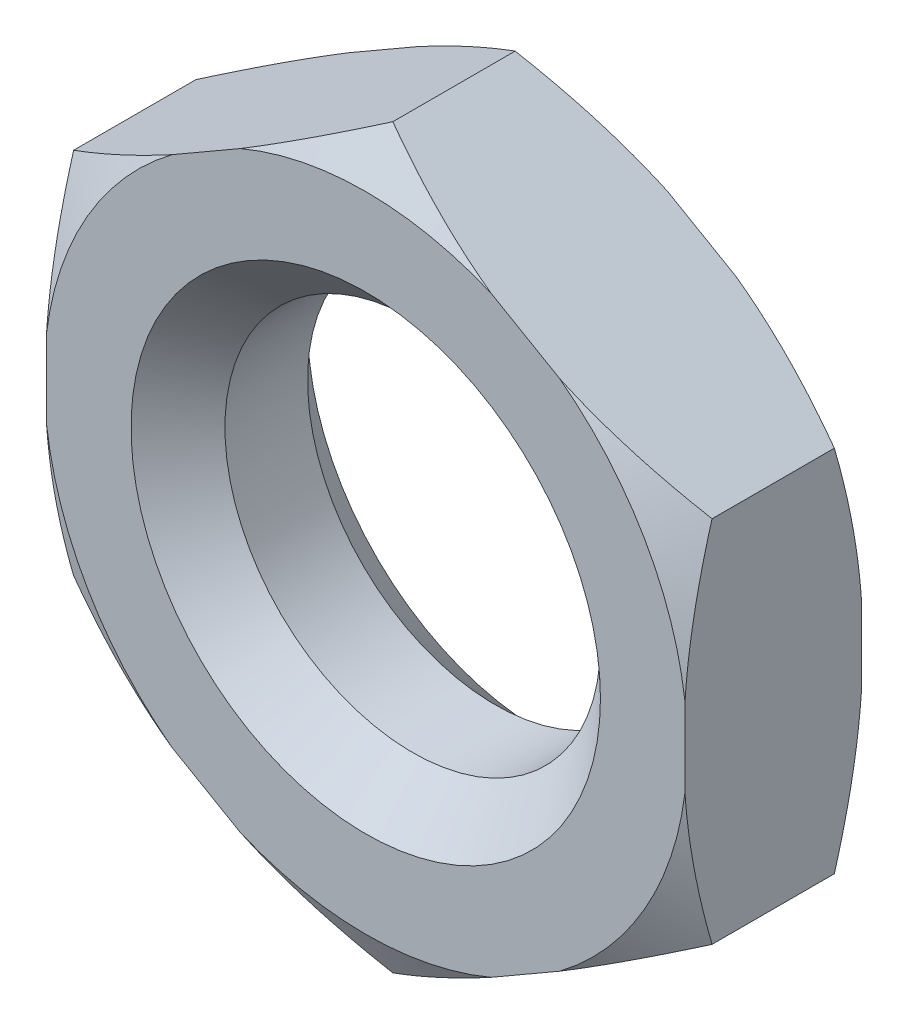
SolidWorks part; units mm, degrees
ref_plane "Front Plane" through (0, 0, 0) normal (0, 0, 1) x (1, 0, 0)
ref_plane "Top Plane" through (0, 0, 0) normal (0, 1, 0) x (1, 0, 0)
ref_plane "Right Plane" through (0, 0, 0) normal (1, 0, 0) x (0, 0, -1)
sketch "Sketch3" plane through (0, 0, 0) normal (0, 0, 1) x (1, 0, 0)
  line L1 (0, 9.815) -> (-8.5, 4.9075)
  line L2 (-8.5, 4.9075) -> (-8.5, -4.9075)
  line L3 (-8.5, -4.9075) -> (0, -9.815)
  line L4 (0, -9.815) -> (8.5, -4.9075)
  line L5 (8.5, -4.9075) -> (8.5, 4.9075)
  line L6 (8.5, 4.9075) -> (0, 9.815)
  circle A0 centre (0, 0) radius 8.5 construction
  dimension "D1" = 17
extrude "Boss-Extrude1" add sketch "Sketch3" along normal mid plane 4.7
sketch "Sketch4" plane through (0, 0, 0) normal (1, 0, 0) x (0, 0, -1)
  line L0 (-5.4578, 0) -> (6.1545, 0) construction
sketch "Sketch5" plane through (0, 0, 0) normal (1, 0, 0) x (0, 0, -1)
  line L0 (-2.35, 9.815) -> (-2.35, 8.565)
  line L1 (-2.35, 4.9075) -> (-2.35, 9.815) construction
  line L2 (-2.35, 8.565) -> (-1.6283, 9.815)
  line L3 (-2.35, 9.815) -> (2.35, 9.815) construction
  line L4 (-1.6283, 9.815) -> (-2.35, 9.815)
  dimension "D1" = 1.25
  dimension "D2" = 30
revolve "Cut-Revolve1" cut sketch "Sketch5" angle 360 about L0
mirror "Mirror1" about plane through (0, 0, 0) normal (0, 0, 1) of "Cut-Revolve1"
sketch "Sketch6" plane through (0, 0, 2.35) normal (0, 0, 1) x (1, 0, 0)
  circle A0 centre (0, 0) radius 5
  dimension "D1" = 10
extrude "Cut-Extrude1" cut sketch "Sketch6" against normal blind 4.7
chamfer "Chamfer1" distance 1.25 angle 45 2 edges at (5, 0, -2.35) (5, 0, 2.35)
